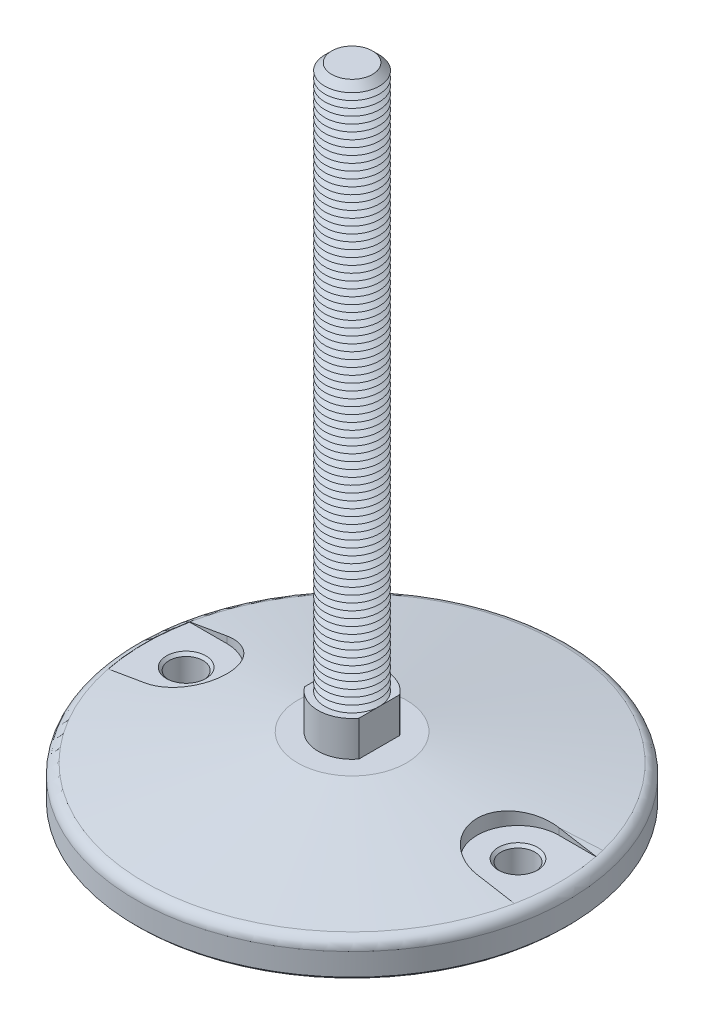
SolidWorks part; units mm, degrees
ref_plane "Front Plane" through (0, 0, 0) normal (0, 0, 1) x (1, 0, 0)
ref_plane "Top Plane" through (0, 0, 0) normal (0, 1, 0) x (1, 0, 0)
ref_plane "Right Plane" through (0, 0, 0) normal (1, 0, 0) x (0, 0, -1)
sketch "Sketch1" plane through (0, 0, 0) normal (1, 0, 0) x (0, 0, -1)
  line L0 (0, 61.3389) -> (0, -58.404) construction
sketch "Sketch2" plane through (0, 0, 0) normal (1, 0, 0) x (0, 0, -1)
  line L0 (0, 0) -> (-20, 0)
  line L1 (-20, 0) -> (-79.5, -10.4915)
  line L2 (-79.5, -10.4915) -> (-79.5, -23)
  line L3 (-79.5, -23) -> (0, -23)
  line L4 (0, 61.3389) -> (0, -58.404) construction
  line L5 (0, -23) -> (0, 0)
  dimension "D1" = 23
  dimension "D2" = 79.5
  dimension "D3" = 20
  dimension "D4" = 10
revolve "Revolve1" add sketch "Sketch2" angle 360 about L0
fillet "Fillet1" radius 4 1 edges at (0, -10.4915, 79.5)
sketch "Sketch3" plane through (0, 0, 0) normal (0, 1, 0) x (1, 0, 0)
  circle A0 centre (0, 0) radius 12.5
  dimension "D1" = 25
extrude "Boss-Extrude1" add sketch "Sketch3" along normal blind 13
sketch "Sketch4" plane through (0, 13, 0) normal (0, 1, 0) x (1, 0, 0)
  line L0 (-10, 7.5) -> (-10, -7.5)
  line L2 (10, -7.5) -> (10, 7.5)
  arc A0 (-10, 7.5) -> (-10, -7.5) centre (0, 0) ccw
  circle A1 centre (0, 0) radius 12.5 construction
  arc A2 (10, -7.5) -> (10, 7.5) centre (0, 0) ccw
  dimension "D1" = 20
extrude "Cut-Extrude1" cut sketch "Sketch4" against normal blind 13
sketch "Sketch5" plane through (0, 13, 0) normal (0, 1, 0) x (1, 0, 0)
  circle A0 centre (0, 0) radius 10
  dimension "D1" = 20
extrude "Boss-Extrude2" add sketch "Sketch5" along normal blind 200
chamfer "Chamfer1" distance 2.5 angle 45 1 edges at (0, 213, 10)
sketch "Sketch6" plane through (0, 0, 0) normal (1, 0, 0) x (0, 0, -1)
  line L0 (-10, 13) -> (-7.8349, 14.25)
  line L1 (-7.8349, 14.25) -> (-10, 15.5)
  line L2 (-10, 210.5) -> (-10, 13) construction
  line L3 (-10, 15.5) -> (-10, 13)
  dimension "D1" = 2.5
revolve "Cut-Revolve1" cut sketch "Sketch6" angle 360 about L0
pattern_linear "LPattern1" count 79 spacing 2.5 along (0, 1, 0) of "Cut-Revolve1"
sketch "Sketch8" plane through (0, 0, 0) normal (0, 1, 0) x (1, 0, 0)
  line L0 (-61, 15) -> (-74.7035, 15)
  line L1 (-61, -15) -> (-74.7035, -15)
  arc A1 (-74.7035, 15) -> (-74.7035, -15) centre (0, 0) ccw
  circle A2 centre (0, 0) radius 76.1946 construction
  arc A3 (-61, -15) -> (-61, 15) centre (-61, 0) ccw
  point P3 (-61, 0)
  point P11 (0, 0)
  dimension "D1" = 61
  dimension "D2" = 30
extrude "Cut-Extrude4" cut sketch "Sketch8" against normal blind 10
sketch "Sketch10" plane through (0, -10, 0) normal (0, 1, 0) x (1, 0, 0)
  circle A0 centre (-61, 0) radius 6.25
  dimension "D1" = 12.5
extrude "Cut-Extrude5" cut sketch "Sketch10" against normal up to surface (13 mm away)
chamfer "Chamfer2" distance 1 angle 45 2 edges at (-61, -23, -6.25) (-61, -10, 6.25)
mirror "Mirror1" about plane through (0, 0, 0) normal (1, 0, 0) of "Chamfer2", "Cut-Extrude5", "Cut-Extrude4"
chamfer "Chamfer3" distance 1 angle 45 1 edges at (0, -23, 79.5)
